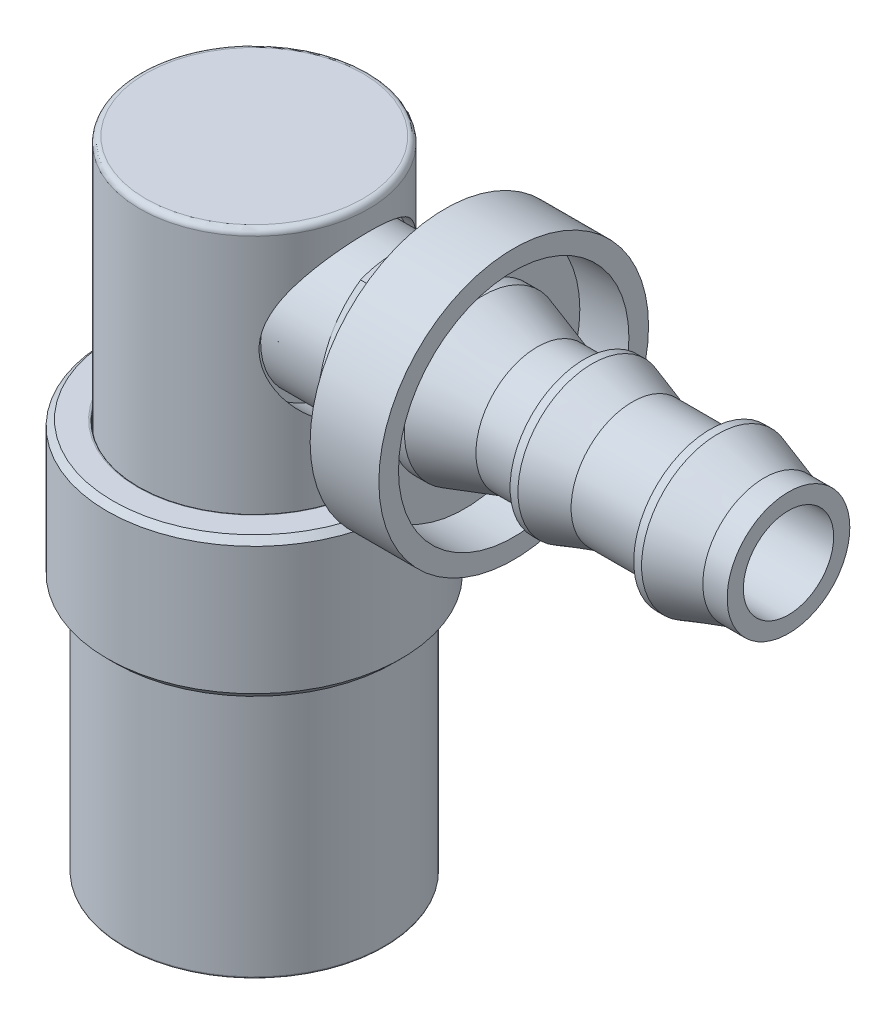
SolidWorks part; units mm, degrees
other "Body_"
ref_plane "Front Plane" through (0, 0, 0) normal (0, 0, 1) x (1, 0, 0)
ref_plane "Top Plane" through (0, 0, 0) normal (0, 1, 0) x (1, 0, 0)
ref_plane "Right Plane" through (0, 0, 0) normal (1, 0, 0) x (0, 0, -1)
imported_body "SC200S"
imported_body "Body"
imported_body "PL-Barb"
imported_body "Sleeve"
imported_body "Barb"
sketch "Sketch1" plane through (0, 0, 0) normal (1, 0, 0) x (0, 0, -1)
  line L0 (-4.7752, 8.1191) -> (-4.7752, 0.7874)
  line L1 (-4.7752, 0.7874) -> (-3.175, 2.3876)
  line L2 (-3.175, 2.3876) -> (-3.175, 7.1952)
  line L3 (-3.175, 7.1952) -> (-4.7752, 8.1191)
  line L4 (-5.0546, 8.2804) -> (-4.7752, 8.1191) construction
  line L5 (-5.5626, 0) -> (-4.7752, 0.7874) construction
  line L6 (0, 7.5824) -> (0, -1.5706) construction
  dimension "D1" = 3.175
revolve "Revolve1" add sketch "Sketch1" angle 360 about L6
sketch "Sketch2" plane through (0, 0, 0) normal (0, -1, 0) x (1, 0, 0)
  line L1 (0, 5.2793) -> (-4.572, 2.6396)
  line L2 (-4.572, 2.6396) -> (-4.572, -2.6396)
  line L3 (-4.572, -2.6396) -> (0, -5.2793)
  line L4 (0, -5.2793) -> (4.572, -2.6396)
  line L5 (4.572, -2.6396) -> (4.572, 2.6396)
  line L6 (4.572, 2.6396) -> (0, 5.2793)
  circle A0 centre (0, 0) radius 4.572 construction
  dimension "D1" = 9.144
extrude "Cut-Extrude1" cut sketch "Sketch2" against normal up to surface (9.3379 mm away)
